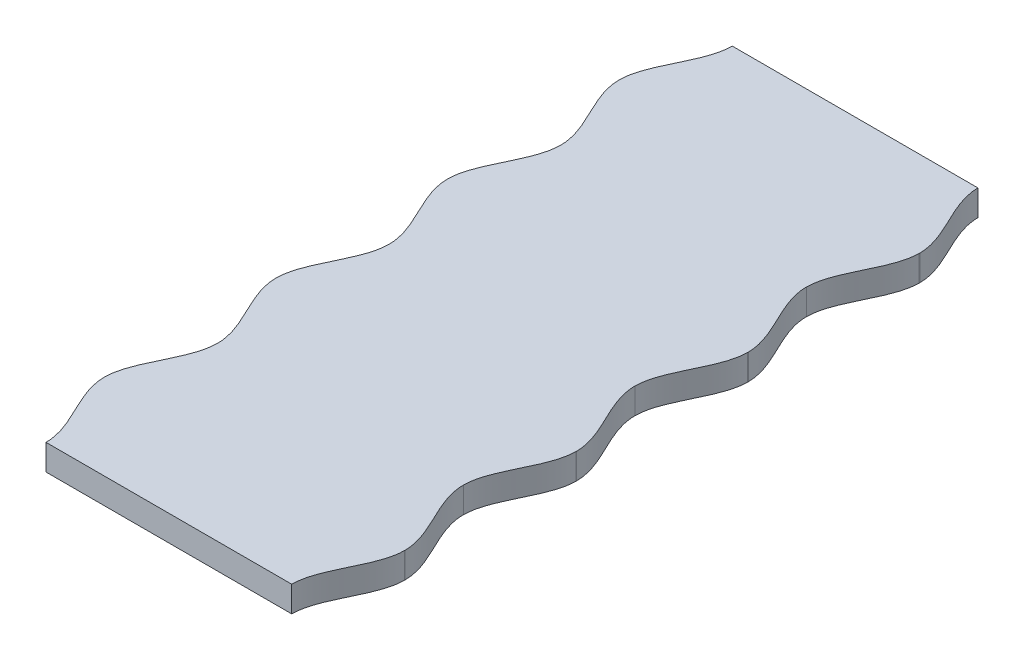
SolidWorks part; units mm, degrees
ref_plane "Front Plane" through (0, 0, 0) normal (0, 0, 1) x (1, 0, 0)
ref_plane "Top Plane" through (0, 0, 0) normal (0, 1, 0) x (1, 0, 0)
ref_plane "Right Plane" through (0, 0, 0) normal (1, 0, 0) x (0, 0, -1)
sketch "Sketch2" plane through (0, 0, 0) normal (0, 1, 0) x (1, 0, 0)
  line L0 (-14.3197, 80) -> (14.3197, 80)
  line L1 (17.5008, 70.0446) -> (17.5008, 69.9552)
  line L2 (17.5008, 50.0446) -> (17.5008, 49.9553)
  line L3 (17.5008, 30.0446) -> (17.5008, 29.9553)
  line L4 (17.5008, 10.0447) -> (17.5008, 9.9553)
  line L5 (14.3197, 0) -> (-14.3197, 0)
  line L6 (-17.4992, 9.8437) -> (-17.4992, 10.1563)
  line L7 (-17.4992, 29.8437) -> (-17.4992, 30.1562)
  line L8 (-17.4992, 49.8437) -> (-17.4992, 50.1562)
  line L9 (-17.4992, 69.8436) -> (-17.4992, 70.1561)
  spline S0 degree 3 poles (14.3197, 80) (14.3197, 76.6816) (17.4728, 73.3629) (17.5008, 70.0446) knots 0.038462 0.038462 0.038462 0.038462 0.076923 0.076923 0.076923 0.076923
  spline S1 degree 3 poles (17.5008, 69.9552) (17.4728, 66.6368) (14.3197, 63.3183) (14.3197, 59.9999) knots 0.115385 0.115385 0.115385 0.115385 0.153846 0.153846 0.153846 0.153846
  spline S2 degree 3 poles (14.3197, 59.9999) (14.3197, 56.6815) (17.4728, 53.363) (17.5008, 50.0446) knots 0.153846 0.153846 0.153846 0.153846 0.192308 0.192308 0.192308 0.192308
  spline S3 degree 3 poles (17.5008, 49.9553) (17.4728, 46.6369) (14.3197, 43.3183) (14.3197, 39.9999) knots 0.230769 0.230769 0.230769 0.230769 0.269231 0.269231 0.269231 0.269231
  spline S4 degree 3 poles (14.3197, 39.9999) (14.3197, 36.6815) (17.4728, 33.363) (17.5008, 30.0446) knots 0.269231 0.269231 0.269231 0.269231 0.307692 0.307692 0.307692 0.307692
  spline S5 degree 3 poles (17.5008, 29.9553) (17.4728, 26.6369) (14.3197, 23.3184) (14.3197, 20) knots 0.346154 0.346154 0.346154 0.346154 0.384615 0.384615 0.384615 0.384615
  spline S6 degree 3 poles (14.3197, 20) (14.3197, 16.6816) (17.4728, 13.363) (17.5008, 10.0447) knots 0.384615 0.384615 0.384615 0.384615 0.423077 0.423077 0.423077 0.423077
  spline S7 degree 3 poles (17.5008, 9.9553) (17.4728, 6.6369) (14.3197, 3.3184) (14.3197, 0) knots 0.461538 0.461538 0.461538 0.461538 0.5 0.5 0.5 0.5
  spline S8 degree 3 poles (-14.3197, 0) (-14.3197, 3.2812) (-17.4028, 6.5625) (-17.4992, 9.8437) knots 0.538462 0.538462 0.538462 0.538462 0.576923 0.576923 0.576923 0.576923
  spline S9 degree 3 poles (-17.4992, 10.1563) (-17.4028, 13.4374) (-14.3197, 16.7188) (-14.3197, 20) knots 0.615385 0.615385 0.615385 0.615385 0.653846 0.653846 0.653846 0.653846
  spline S10 degree 3 poles (-14.3197, 20) (-14.3197, 23.2812) (-17.4028, 26.5625) (-17.4992, 29.8437) knots 0.653846 0.653846 0.653846 0.653846 0.692308 0.692308 0.692308 0.692308
  spline S11 degree 3 poles (-17.4992, 30.1562) (-17.4028, 33.4374) (-14.3197, 36.7187) (-14.3197, 39.9999) knots 0.730769 0.730769 0.730769 0.730769 0.769231 0.769231 0.769231 0.769231
  spline S12 degree 3 poles (-14.3197, 39.9999) (-14.3197, 43.2811) (-17.4028, 46.5625) (-17.4992, 49.8437) knots 0.769231 0.769231 0.769231 0.769231 0.807692 0.807692 0.807692 0.807692
  spline S13 degree 3 poles (-17.4992, 50.1562) (-17.4028, 53.4374) (-14.3197, 56.7187) (-14.3197, 59.9999) knots 0.846154 0.846154 0.846154 0.846154 0.884615 0.884615 0.884615 0.884615
  spline S14 degree 3 poles (-14.3197, 59.9999) (-14.3197, 63.2811) (-17.4028, 66.5624) (-17.4992, 69.8436) knots 0.884615 0.884615 0.884615 0.884615 0.923077 0.923077 0.923077 0.923077
  spline S15 degree 3 poles (-17.4992, 70.1561) (-17.4028, 73.4373) (-14.3197, 76.7188) (-14.3197, 80) knots 0.961538 0.961538 0.961538 0.961538 1 1 1 1
extrude "Boss-Extrude1" add sketch "Sketch2" along normal blind 3
